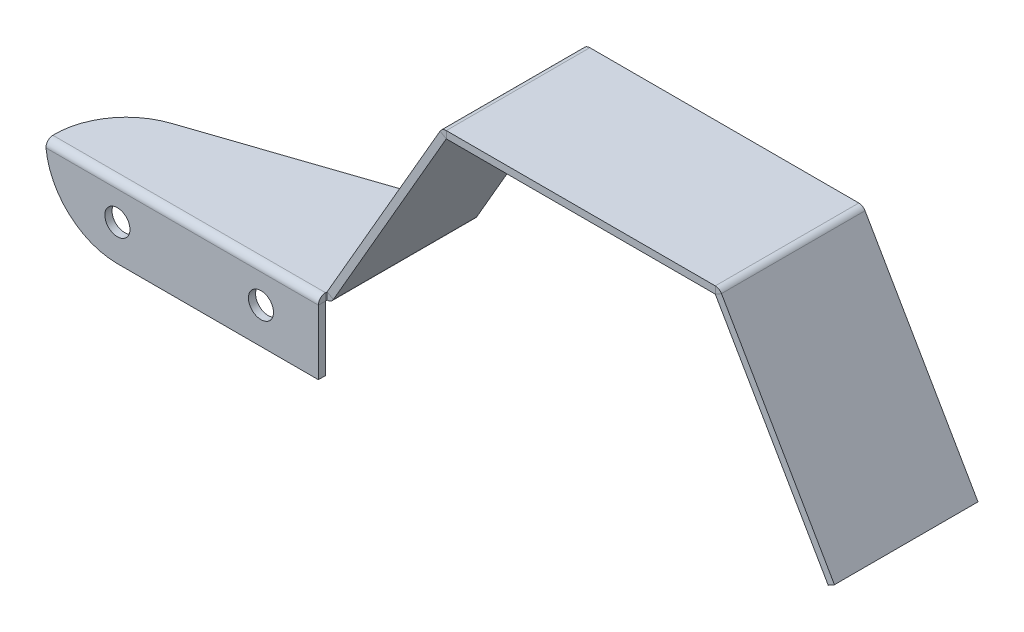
SolidWorks part; units mm, degrees
ref_plane "Front Plane" through (0, 0, 0) normal (0, 0, 1) x (1, 0, 0)
ref_plane "Top Plane" through (0, 0, 0) normal (0, 1, 0) x (1, 0, 0)
ref_plane "Right Plane" through (0, 0, 0) normal (1, 0, 0) x (0, 0, -1)
sketch "Sketch1" plane through (0, 0, 0) normal (0, 0, 1) x (1, 0, 0)
  line L0 (0, 0) -> (102, 0)
  line L1 (102, 0) -> (102, 20)
  line L2 (102, 20) -> (0, 20)
  line L3 (0, 0) -> (0, -10)
  line L4 (0, -10) -> (-28, -10)
  line L5 (-28, -10) -> (-28, 0) construction
  line L6 (0, 20) -> (-31.1966, 9.4753)
  line L7 (0, 0) -> (0, 20) construction
  line L8 (0, 0) -> (-28, 0) construction
  line L9 (0, -5) -> (-28, -5) construction
  arc A0 (-31.1966, 9.4753) -> (-28, -10) centre (-28, 0) ccw
  circle A1 centre (-8, -5) radius 1.75
  circle A2 centre (-28, -5) radius 1.75
  dimension "D3" = 10
  dimension "D5" = 8
  dimension "D6" = 3.5
  dimension "D1" = 20
  dimension "D2" = 102
  dimension "D4" = 28
sheet metal parameters "Sheet-Metal1" thickness 1 parameters "D1"=0.7366
base flange "Base-Flange1" sketch "Sketch1" thickness 1 reverse thickness direction no parameters "D1"=0.7366
sketch "Sketch3" plane through (0, 0, 0) normal (0, 0, 1) x (1, 0, 0)
  line L0 (0, 0) -> (-34.1727, 0)
sketched bend "Sketched Bend1" parameters "D1"=0.001
bend "SketchBend1" bend radius 0.001 bend angle 90 parameters "D5"=1
sketch "Sketch4" plane through (0, 0, 0) normal (0, 1, 0) x (1, 0, 0)
  line L0 (0, 21.215) -> (0, 8.6421)
sketched bend "Sketched Bend3" parameters "D1"=0.001
bend "SketchBend3" bend radius 0.001 bend angle 60 parameters "D5"=2
sketch "Sketch5" plane through (0.0004, -0.0002, 0) normal (-0.866, 0.5, 0) x (0, 0, 1)
  line L0 (-1.215, 31.4762) -> (-21.215, 31.4762)
  line L1 (-1.215, 0.0009) -> (-1.215, 101.4762) construction
  line L2 (-21.215, 101.4762) -> (-21.215, 0.0009) construction
  line L3 (-1.215, 69.4762) -> (-21.215, 69.4762)
  line L4 (-1.215, 101.4762) -> (-21.215, 101.4762) construction
  dimension "D1" = 32
  dimension "D2" = 38
sketched bend "Sketched Bend4" parameters "D1"=0
bend "SketchBend4" bend radius 0 bend angle 60 parameters "D5"=3
bend "SketchBend5" bend radius 0 bend angle 60 parameters "D5"=4
flat pattern "Flat-Pattern1"
sketch "Bend-Lines1" plane through (0, 26.7595, 0) normal (0, -1, 0) x (1, 0, 0)
  line L0 (54.3431, -21.215) -> (54.3431, -1.215) construction
  line L1 (16.3431, -21.215) -> (16.3431, -1.215) construction
  line L2 (-15.6569, -1.215) -> (-15.6569, -21.215) construction
  line L3 (-53.9007, -0.6075) -> (-15.9192, -0.6075) construction
sketch3d "Bounding-Box1" [suppressed]
  line L0 (130, -20, 0) -> (-9.9999, -20, 0) construction
  line L1 (130, 9.9999, 0) -> (-9.9999, 10, 0) construction
  line L2 (130, -20, 0) -> (130, 9.9999, 0) construction
  line L3 (-9.9999, -20, 0) -> (-9.9999, 10, 0) construction
bend of the flat pattern "Flatten-<SketchBend1>1"
bend of the flat pattern "Flatten-<SketchBend3>1"
bend of the flat pattern "Flatten-<SketchBend4>1"
bend of the flat pattern "Flatten-<SketchBend5>1"
